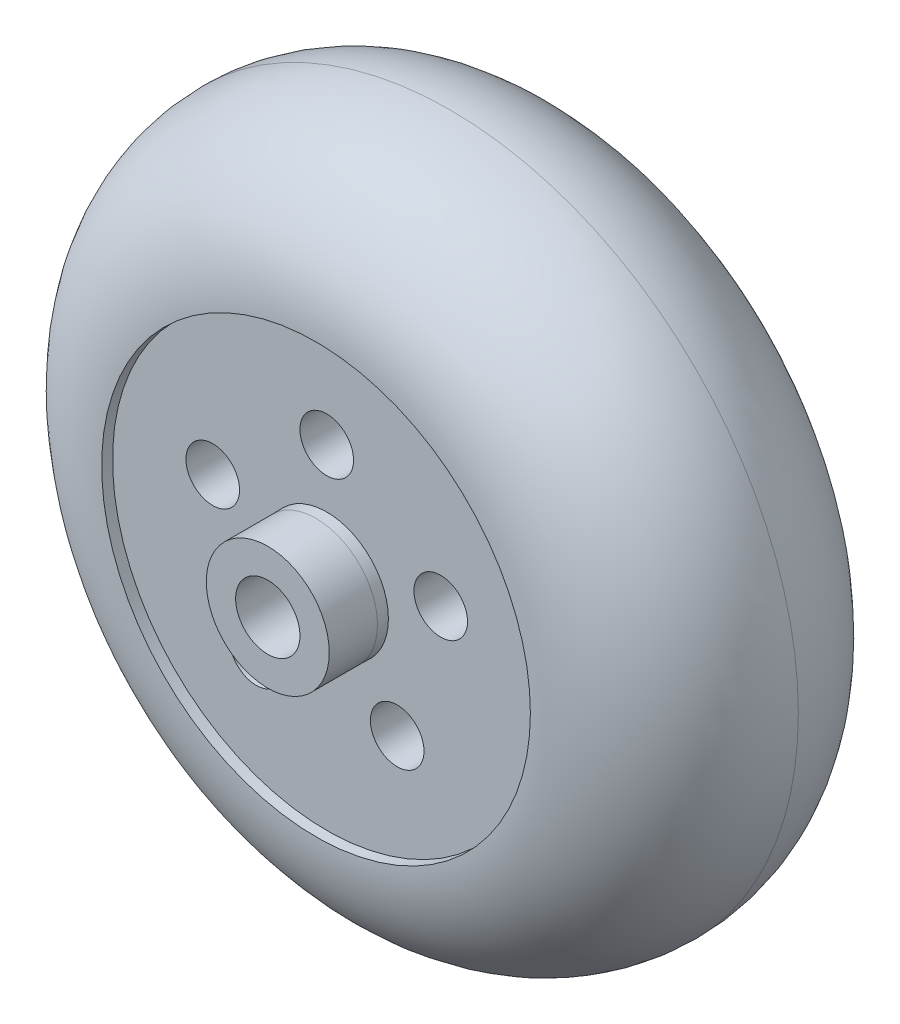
SolidWorks part; units mm, degrees
ref_plane "Alzado" through (0, 0, 0) normal (0, 0, 1) x (1, 0, 0)
ref_plane "Planta" through (0, 0, 0) normal (0, 1, 0) x (1, 0, 0)
ref_plane "Vista lateral" through (0, 0, 0) normal (1, 0, 0) x (0, 0, -1)
sketch "Croquis1" plane through (0, 0, 0) normal (0, 0, 1) x (1, 0, 0)
  circle A0 centre (0, 0) radius 32.5
  dimension "D1" = 65
extrude "Saliente-Extruir1" add sketch "Croquis1" along normal blind 25
fillet "Redondeo1" radius 12.5 1 edges at (32.5, 0, 25)
fillet "Redondeo2" radius 12.5 1 edges at (32.5, 0, 0)
sketch "Croquis2" plane through (0, 0, 25) normal (0, 0, 1) x (1, 0, 0)
  circle A0 centre (0, 0) radius 3
  dimension "D1" = 6
extrude "Cortar-Extruir1" cut sketch "Croquis2" against normal blind 25
sketch "Croquis3" plane through (0, 0, 25) normal (0, 0, 1) x (1, 0, 0)
  circle A0 centre (0, 0) radius 5.7351
  circle A1 centre (0, 0) radius 20
extrude "Cortar-Extruir2" cut sketch "Croquis3" against normal blind 1 draft 1
sketch "Croquis4" plane through (0, 0, 24) normal (0, 0, 1) x (1, 0, 0)
  line L0 (0, 20) -> (0, -19.9825) construction
  line L1 (-20, 0) -> (19.9825, 0) construction
  circle A0 centre (0, 0) radius 20 construction
  circle A1 centre (0, 0) radius 19.9825 construction
  circle A3 centre (0, 11.1824) radius 2.5
  circle A4 centre (10.6351, 3.4555) radius 2.5
  circle A5 centre (6.5728, -9.0467) radius 2.5
  circle A6 centre (-6.5728, -9.0467) radius 2.5
  circle A7 centre (-10.6351, 3.4555) radius 2.5
  point P22 (0, 0)
  dimension "D1" = 5
  dimension "D2" = 5
extrude "Cortar-Extruir4" cut sketch "Croquis4" against normal through all
sketch "Croquis5" plane through (0, 0, 0) normal (0, 0, -1) x (-1, 0, 0)
  circle A0 centre (0, 0) radius 6
  circle A1 centre (0, 0) radius 20
  dimension "D1" = 12
extrude "Cortar-Extruir5" cut sketch "Croquis5" against normal blind 1
sketch "Croquis6" plane through (0, 0, 25) normal (0, 0, 1) x (1, 0, 0)
  circle A0 centre (0, 0) radius 5.7351
  circle A1 centre (0, 0) radius 3
extrude "Saliente-Extruir2" add sketch "Croquis6" along normal blind 4.5
sketch "Croquis7" plane through (0, 0, 0) normal (0, 0, -1) x (-1, 0, 0)
  circle A0 centre (0, 0) radius 3
  circle A1 centre (0, 0) radius 6
extrude "Saliente-Extruir3" add sketch "Croquis7" along normal blind 4.5
